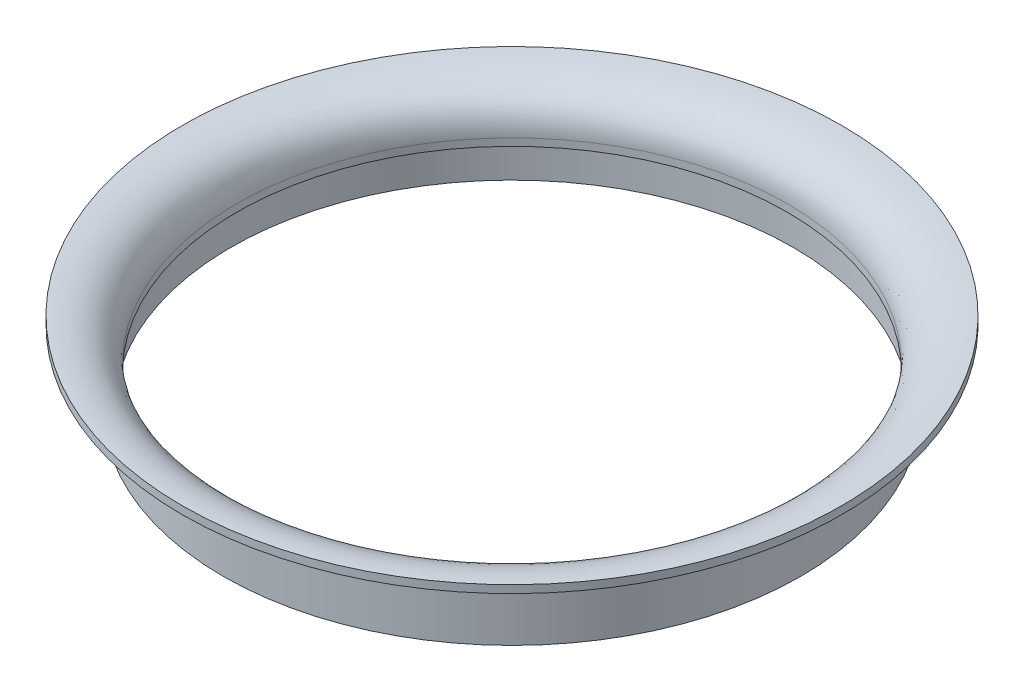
SolidWorks part; units mm, degrees
ref_plane "Спереди" through (0, 0, 0) normal (0, 0, 1) x (1, 0, 0)
ref_plane "Сверху" through (0, 0, 0) normal (0, 1, 0) x (1, 0, 0)
ref_plane "Справа" through (0, 0, 0) normal (1, 0, 0) x (0, 0, -1)
sketch "Эскиз1" plane through (0, 0, 0) normal (0, 0, 1) x (1, 0, 0)
  line L0 (0, 0) -> (36.25, 0)
  line L1 (36.25, 0) -> (37.25, 0)
  line L2 (37.25, 0) -> (37.25, 6)
  line L5 (42.5, 9.5) -> (42.5, 10.5)
  line L8 (35.5, 4.3) -> (36.25, 4.3)
  line L9 (36.25, 4.3) -> (36.25, 0)
  line L10 (37.25, 7.4) -> (37.25, 2.3522) construction
  line L11 (45.306, 9.5) -> (39.694, 9.5) construction
  line L12 (45.4759, 10.5) -> (39.5241, 10.5) construction
  line L13 (35.5, 9.5574) -> (35.5, 5.4485) construction
  line L14 (35.5, 5.2463) -> (35.5, 4.3)
  line L15 (0, 0) -> (0, 7.7543) construction
  spline S0 degree 3 poles (37.25, 6) (37.25, 8.1032) (38.9924, 9.5) (42.5, 9.5) knots 0 0 0 0 1 1 1 1
  spline S1 degree 3 poles (35.5, 5.2463) (35.5, 8.1434) (37.3082, 10.5) (42.5, 10.5) knots 0 0 0 0 1 1 1 1
  dimension "D2" = 36.25
  dimension "D3" = 1
  dimension "D4" = 6
  dimension "D7" = 4.3
revolve "Повернуть1" add sketch "Эскиз1" angle 360 about L15
